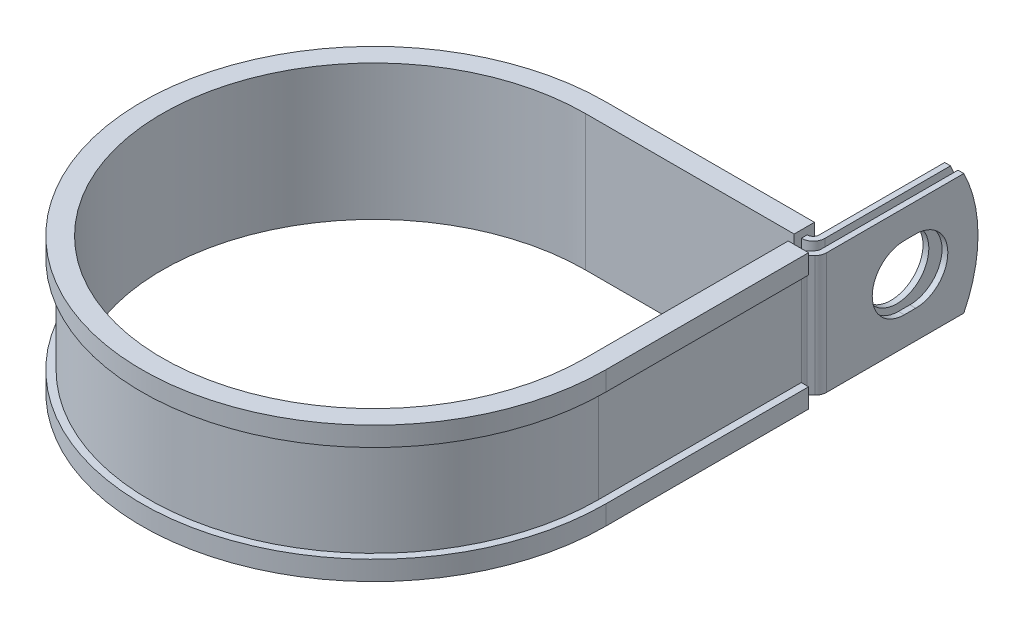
SolidWorks part; units mm, degrees
ref_plane "Front Plane" through (0, 0, 0) normal (0, 0, 1) x (1, 0, 0)
ref_plane "Top Plane" through (0, 0, 0) normal (0, 1, 0) x (1, 0, 0)
ref_plane "Right Plane" through (0, 0, 0) normal (1, 0, 0) x (0, 0, -1)
sketch "Sketch1" plane through (0, 0, 0) normal (0, 1, 0) x (1, 0, 0)
  line L0 (0, 45.974) -> (43.8583, 45.974)
  line L1 (45.974, 0) -> (45.974, 42.5615)
  line L2 (46.2967, 77.7748) -> (46.2967, 48.4124)
  line L3 (46.6882, 44.2857) -> (47.5144, 45.1119)
  line L5 (47.8715, 45.974) -> (47.8715, 77.7748)
  arc A0 (0, 45.974) -> (45.974, 0) centre (0, 0) ccw
  arc A1 (46.6882, 44.2857) -> (45.974, 42.5615) centre (48.4124, 42.5615) ccw
  arc A2 (47.5144, 45.1119) -> (47.8715, 45.974) centre (46.6523, 45.974) ccw
  arc A3 (43.8583, 45.974) -> (46.2967, 48.4124) centre (43.8583, 48.4124) ccw
extrude "Extrude-Thin1" add sketch "Sketch1" along normal mid plane 25.4 thin
sketch "Sketch2" plane through (45.0775, 0, 0) normal (-1, 0, 0) x (0, 0, 1)
  line L0 (-77.7748, 12.7) -> (-77.7748, -12.7) construction
  line L1 (0, 12.7) -> (0, -12.7) construction
  circle A0 centre (-63.5, 0) radius 6.7437
  point P2 (-77.7748, 0)
extrude "Cut-Extrude1" cut sketch "Sketch2" against normal up to surface (1.2192 mm away)
sketch "Sketch3" plane through (49.0907, 0, 0) normal (1, 0, 0) x (0, 0, -1)
  line L0 (62.3062, 0) -> (64.6938, 0) construction
  line L1 (62.3062, 6.7437) -> (64.6938, 6.7437)
  line L2 (62.3062, -6.7437) -> (64.6938, -6.7437)
  line L3 (77.7748, 12.7) -> (77.7748, -12.7) construction
  arc A0 (62.3062, 6.7437) -> (62.3062, -6.7437) centre (62.3062, 0) ccw
  arc A1 (64.6938, -6.7437) -> (64.6938, 6.7437) centre (64.6938, 0) ccw
  point P3 (63.5, 0)
  point P8 (77.7748, 0)
  point P11 (55.5625, 0)
  point P12 (71.4375, 0)
extrude "Cut-Extrude2" cut sketch "Sketch3" against normal up to surface (1.2192 mm away)
sketch "Sketch4" plane through (45.0775, 0, 0) normal (-1, 0, 0) x (0, 0, 1)
  line L0 (-77.7748, 12.7) -> (-77.7748, -12.7)
  line L1 (-77.7748, 12.7) -> (-74.7975, 12.7)
  line L2 (-77.7748, 12.7) -> (-48.4124, 12.7) construction
  line L3 (-77.7748, -12.7) -> (-74.7975, -12.7)
  line L4 (-77.7748, -12.7) -> (-48.4124, -12.7) construction
  arc A0 (-74.7975, 12.7) -> (-74.7975, -12.7) centre (-49.1998, 0) ccw
extrude "Cut-Extrude3" cut sketch "Sketch4" against normal through all contours A0 M4 M5 | A0 L0 M2
ref_plane "Plane1" through (0, 0, -42.5615) normal (0, 0, -1) x (-1, 0, 0)
ref_plane "Plane2" through (43.8075, 0, 0) normal (-1, 0, 0) x (0, 0, 1)
sketch "Sketch5" plane through (0, 0, -42.5615) normal (0, 0, -1) x (-1, 0, 0)
  line L0 (-47.1932, 12.7) -> (-45.974, 12.7)
  line L1 (-47.1932, 12.7) -> (-47.1932, -12.7) construction
  line L3 (-45.974, 12.7) -> (-45.974, -12.7)
  line L4 (-45.974, -12.7) -> (-47.1932, -12.7)
  line L5 (-47.1932, -12.7) -> (-47.1932, -10.16)
  line L6 (-47.1932, 12.7) -> (-47.1932, 10.16)
  line L7 (-48.7172, 14.224) -> (-48.7172, 10.16)
  line L8 (-48.7172, 14.224) -> (-44.45, 14.224)
  line L9 (-44.45, 14.224) -> (-44.45, -14.224)
  line L10 (-44.45, -14.224) -> (-48.7172, -14.224)
  line L11 (-48.7172, -14.224) -> (-48.7172, -10.16)
  line L12 (-48.7172, 10.16) -> (-47.1932, 10.16)
  line L13 (-47.1932, -10.16) -> (-48.7172, -10.16)
sketch "Sketch6" plane through (0, 12.7, 0) normal (0, 1, 0) x (1, 0, 0)
  line L0 (44.45, 0) -> (44.45, 42.5615)
  line L1 (44.45, 42.5615) -> (48.7172, 42.5615) construction
  line L2 (43.8075, 6.9878) -> (43.8075, -6.9878) construction
  line L5 (0, 44.45) -> (43.8075, 44.45)
  arc A0 (0, 44.45) -> (44.45, 0) centre (0, 0) ccw
sweep "Sweep1" add profiles "Sketch5" path "Sketch6"
equation "\"D4@Sketch5\" = \"D1@Extrude-Thin1\""
equation "\"D5@Sketch5\" = \"D5@Extrude-Thin1\""
equation "\"D1@Sketch3\" = \"D2@Sketch2\""
equation "\"D7@Sketch1\" = \"D3@Sketch2\" + \"D1@Sketch3\""
equation "\"D1@Sketch1\" = \"D1@Sketch6\" + 2 * \"D3@Sketch5\""
equation "\"D1@Sketch4\" = ( \"D1@Extrude-Thin1\" + .125 ) * 2"
equation "\"D9@Sketch1\"= \"D5@Extrude-Thin1\""
equation "\"D8@Sketch1\"= 2 * \"D5@Extrude-Thin1\""
equation "\"D2@Sketch1\" = 2 * \"D5@Extrude-Thin1\""
equation "\"D2@Sketch3\" = \"D1@Sketch2\""
